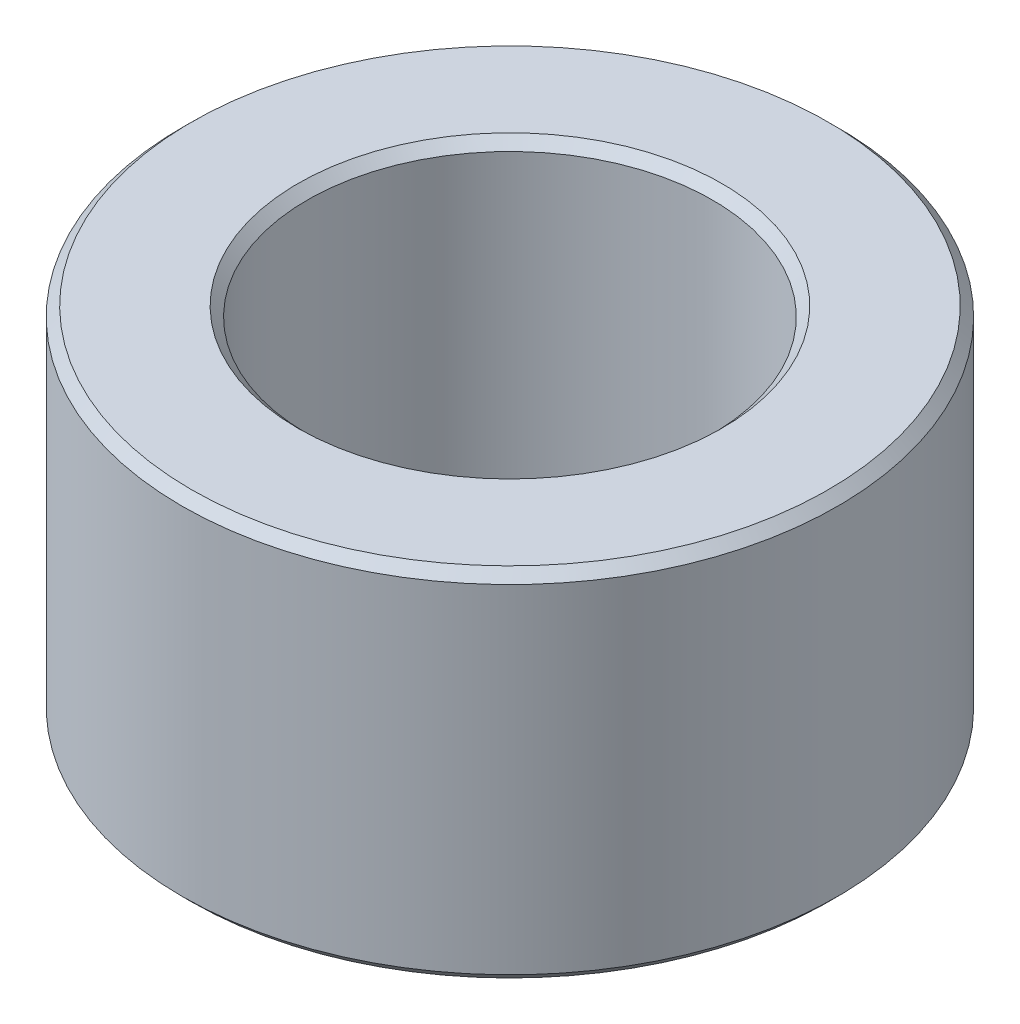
SolidWorks part; units mm, degrees
ref_plane "Front Plane" through (0, 0, 0) normal (0, 0, 1) x (1, 0, 0)
ref_plane "Top Plane" through (0, 0, 0) normal (0, 1, 0) x (1, 0, 0)
ref_plane "Right Plane" through (0, 0, 0) normal (1, 0, 0) x (0, 0, -1)
sketch "Sketch2" plane through (0, 0, 0) normal (0, 1, 0) x (1, 0, 0)
  circle A0 centre (0, 0) radius 8.636
  dimension "D1" = 17.272
extrude "Extrude-Thin1" add sketch "Sketch2" along normal mid plane 9.4 thin
chamfer "Chamfer1" distance 0.25 angle 45 4 edges at (5.334, -4.7, 0) (0, -4.7, 8.636) (5.334, 4.7, 0) (0, 4.7, 8.636)
